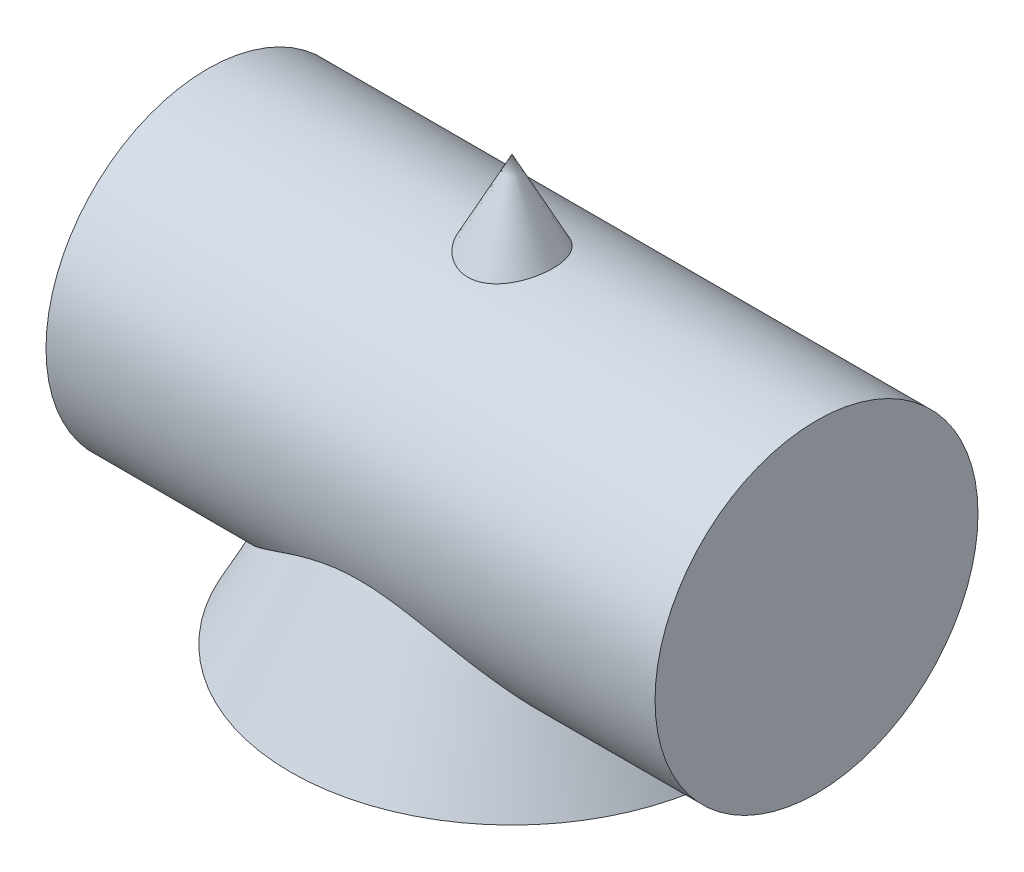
SolidWorks part; units mm, degrees
ref_plane "前视" through (0, 0, 0) normal (0, 0, 1) x (1, 0, 0)
ref_plane "上视" through (0, 0, 0) normal (0, 1, 0) x (1, 0, 0)
ref_plane "右视" through (0, 0, 0) normal (1, 0, 0) x (0, 0, -1)
sketch "草图1" plane through (0, 0, 0) normal (0, 0, 1) x (1, 0, 0)
  line L0 (0, 0) -> (-24, 0)
  line L1 (-24, 0) -> (0, 46)
  line L2 (0, 46) -> (0, 0)
  line L3 (0, 0) -> (0, -21.9098) construction
  dimension "D1" = 48
  dimension "D2" = 46
revolve "旋转1" add sketch "草图1" angle 360 about L3
sketch "草图2" plane through (0, 0, 0) normal (1, 0, 0) x (0, 0, -1)
  circle A0 centre (0, 20) radius 17.5
  dimension "D1" = 35
  dimension "D2" = 20
extrude "拉伸1" add sketch "草图2" along normal mid plane 66
